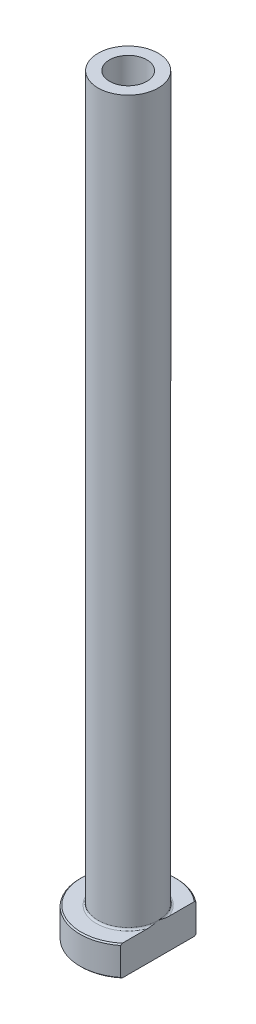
SolidWorks part; units mm, degrees
ref_plane "Front Plane" through (0, 0, 0) normal (0, 0, 1) x (1, 0, 0)
ref_plane "Top Plane" through (0, 0, 0) normal (0, 1, 0) x (1, 0, 0)
ref_plane "Right Plane" through (0, 0, 0) normal (1, 0, 0) x (0, 0, -1)
sketch "Sketch1" plane through (0, 0, 0) normal (0, 0, 1) x (1, 0, 0)
  line L0 (-3.1, 125) -> (-5, 125)
  line L1 (-5, 125) -> (-5, 5)
  line L2 (-5, 5) -> (-8, 5)
  line L3 (-8, 5) -> (-8, 0)
  line L4 (7.15, 0) -> (-7.15, 0) construction
  line L5 (-8, 0) -> (-3.35, 0)
  line L6 (-3.1, 80) -> (-3.1, 125)
  line L7 (0, 92.1877) -> (0, -15.5353) construction
  line L8 (0, -8.8) -> (0, 8.8) construction
  line L9 (-3.1, 80) -> (-3.35, 68)
  line L10 (-3.35, 68) -> (-3.35, 0)
  dimension "D1" = 0.25
  dimension "ID" = 6.2
  dimension "OD" = 10
  dimension "L" = 125
  dimension "H" = 16
  dimension "T" = 5
  dimension "N" = 45
  dimension "D2" = 12
  dimension "L-N" = 80
revolve "Revolve1" add sketch "Sketch1" angle 360 about L7
fillet "Fillet1" radius 0.3 1 edges at (0, 5, 5)
chamfer "Chamfer1" distance 0.2 angle 45 2 edges at (0, 5, 8) (0, 0, 8)
sketch "Sketch2" plane through (0, 0, 0) normal (0, -1, 0) x (1, 0, 0)
  line L0 (5, 6.245) -> (5, -6.245)
  circle A0 centre (0, 0) radius 8 construction
  arc A1 (5, 6.245) -> (5, -6.245) centre (0, 0) cw
  circle A2 centre (0, 0) radius 5 construction
extrude "Cut-Extrude1" cut sketch "Sketch2" against normal through all
chamfer "Chamfer2" distance 0.5 angle 45 1 edges at (0, 0, 3.35)
